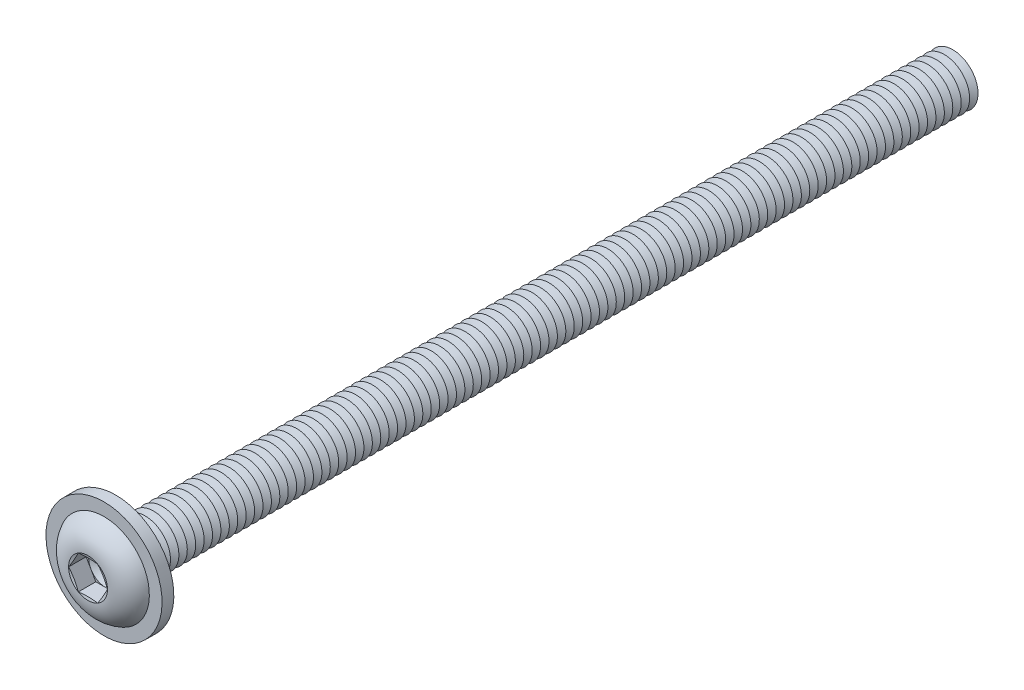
SolidWorks part; units mm, degrees
ref_plane "Front Plane" through (0, 0, 0) normal (0, 0, 1) x (1, 0, 0)
ref_plane "Top Plane" through (0, 0, 0) normal (0, 1, 0) x (1, 0, 0)
ref_plane "Right Plane" through (0, 0, 0) normal (1, 0, 0) x (0, 0, -1)
sketch "Sketch1" plane through (0, 0, 0) normal (1, 0, 0) x (0, 0, -1)
  line L0 (0, 1.5) -> (0, 2.85)
  line L3 (0, 1.5) -> (50, 1.5)
  line L4 (50, 1.5) -> (50, 0)
  line L5 (50, 0) -> (-1.65, 0) construction
  line L6 (-1.65, 0) -> (50, 0)
  line L7 (-1.65, 1.1547) -> (-1.65, 0.5773) construction
  line L8 (-1.65, 0.5773) -> (-1.65, 0)
  line L9 (-1.65, 1.1547) -> (-1.4953, 0.5773)
  line L10 (-1.4953, 0.5773) -> (-1.65, 0.5773)
  line L11 (50, 0) -> (22.7481, 0) construction
  line L12 (0, 2.85) -> (-1.65, 2.85) construction
  arc A1 (0, 2.85) -> (-1.65, 1.1547) centre (0, 1.1994) ccw
  point P8 (50, 0.75)
  dimension "D1" = 5.7
  dimension "D2" = 3
  dimension "D3" = 1.65
  dimension "D4" = 2.3094
  dimension "D5" = 50
  dimension "D6" = 15
revolve "Revolve1" add sketch "Sketch1" angle 360 about L5
fillet "Fillet1" radius 0.25 1 edges at (0, 1.5, 0)
sketch "Sketch2" plane through (0, 0, 0) normal (1, 0, 0) x (0, 0, -1)
  line L0 (49.75, 1.5) -> (50.25, 1.5)
  line L1 (50, 1.5) -> (0.25, 1.5) construction
  line L2 (50.25, 1.5) -> (50, 1.067)
  line L3 (50, -1.5) -> (50, 1.5) construction
  line L4 (50, 1.067) -> (49.75, 1.5)
  dimension "D1" = 0.5
revolve "Cut-Revolve1" cut sketch "Sketch2" angle 360 about axis through (0, 0, -50) along (0, 0, -1)
pattern_linear "LPattern1" count 100 spacing 0.5 along (0, 0, 1) of "Cut-Revolve1"
sketch "Sketch3" plane through (0, 0, 1.65) normal (0, 0, 1) x (1, 0, 0)
  line L7 (0.5773, 1) -> (-0.5774, 1)
  line L8 (-0.5774, 1) -> (-1.1547, 0)
  line L9 (-1.1547, 0) -> (-0.5773, -1)
  line L10 (-0.5773, -1) -> (0.5773, -1)
  line L11 (0.5773, -1) -> (1.1547, 0)
  line L12 (1.1547, 0) -> (0.5773, 1)
  circle A0 centre (0, 0) radius 1 construction
  circle A3 centre (0, 0) radius 1.1547 construction
extrude "Cut-Extrude1" cut sketch "Sketch3" against normal blind 1.04
sketch "Sketch4" plane through (0, 0, 0.61) normal (0, 0, 1) x (1, 0, 0)
  line L1 (0.5773, 1) -> (-0.5774, 1) construction
  circle A0 centre (0, 0) radius 1
extrude "Cut-Extrude2" cut sketch "Sketch4" against normal through all draft 60
sketch "Sketch5" plane through (0, 0, 0) normal (0, 0, -1) x (-1, 0, 0)
  circle A0 centre (0, 0) radius 3.45
  circle A1 centre (0, 0) radius 1.75
  circle A2 centre (0, 0) radius 1.75 construction
  dimension "D1" = 6.9
extrude "Boss-Extrude1" add sketch "Sketch5" against normal blind 0.7
